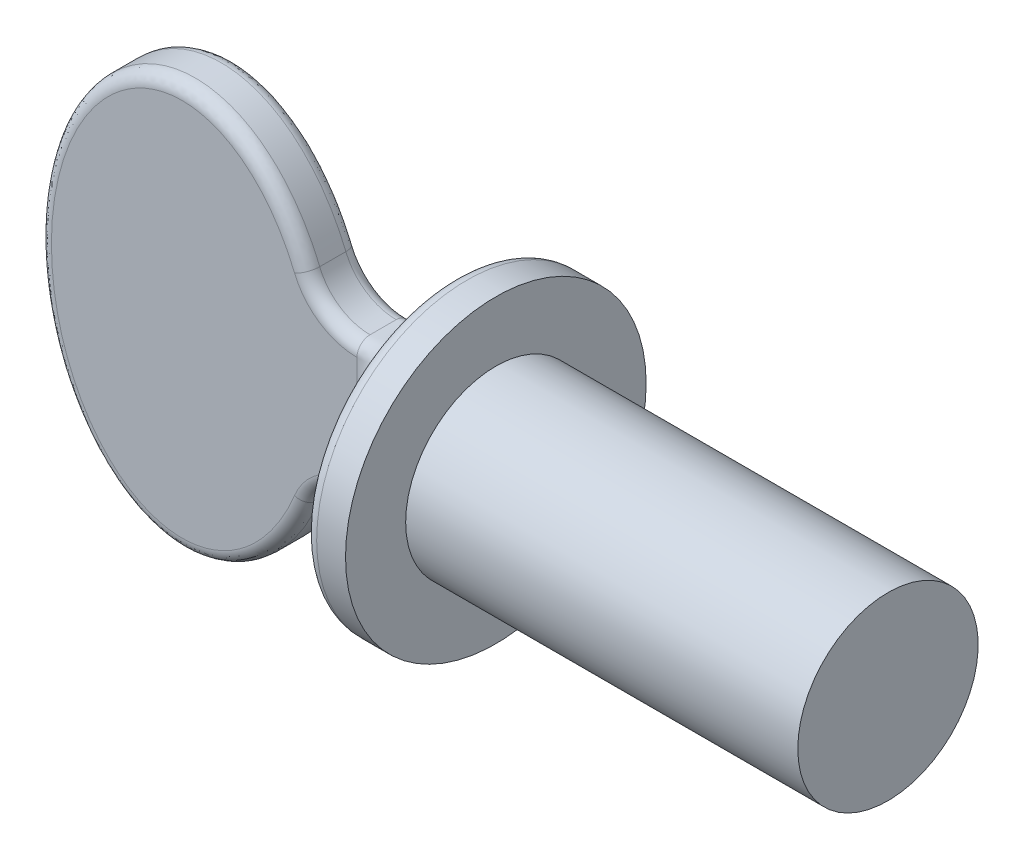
SolidWorks part; units mm, degrees
ref_plane "Front Plane" through (0, 0, 0) normal (0, 0, 1) x (1, 0, 0)
ref_plane "Top Plane" through (0, 0, 0) normal (0, 1, 0) x (1, 0, 0)
ref_plane "Right Plane" through (0, 0, 0) normal (1, 0, 0) x (0, 0, -1)
sketch "layout" plane through (0, 0, 0) normal (0, 0, 1) x (1, 0, 0)
  line L0 (0, 0) -> (13.208, 0) construction
  line L1 (5.588, 2.921) -> (5.588, -2.921)
  line L2 (3.3976, 1.3123) -> (4.8921, 1.3123) construction
  line L3 (5.588, 2.921) -> (4.7897, 2.921)
  line L4 (4.7897, 2.921) -> (4.7897, 3.2655) construction
  line L5 (4.2865, 1.706) -> (4.2865, 0)
  line L6 (4.2865, 1.706) -> (3.3355, 0.7551) construction
  line L7 (13.208, 1.7526) -> (13.208, 0)
  line L8 (3.3976, 1.3123) -> (3.3976, -1.3123)
  line L9 (13.208, 1.7526) -> (5.588, 1.7526)
  arc A0 (3.3976, 1.3123) -> (2.4197, 1.9685) centre (3.3976, 2.3692) cw
  arc A1 (4.7897, 2.921) -> (4.2865, 1.706) centre (3.0715, 2.921) cw
  arc A2 (3.3976, -1.3123) -> (2.4197, -1.9685) centre (3.3976, -2.3692) ccw
  ellipse E0 centre (0, 0) end of major axis (0, 3.937) minor radius 2.794 (2.4197, 1.9685) -> (2.4197, -1.9685) ccw
sketch "Sketch3" plane through (0, 0, 0) normal (0, 0, 1) x (1, 0, 0)
  line L0 (3.3976, 1.3123) -> (3.3976, -1.3123) construction
  line L1 (3.3976, 1.3123) -> (3.3976, -1.3123)
  arc A0 (3.3976, -1.3123) -> (2.4197, -1.9685) centre (3.3976, -2.3692) ccw construction
  arc A1 (2.4197, 1.9685) -> (3.3976, 1.3123) centre (3.3976, 2.3692) ccw construction
  arc A2 (3.3976, -1.3123) -> (2.4197, -1.9685) centre (3.3976, -2.3692) ccw
  arc A3 (2.4197, 1.9685) -> (3.3976, 1.3123) centre (3.3976, 2.3692) ccw
  ellipse E0 centre (0, 0) end of major axis (0, 3.937) minor radius 2.794 (2.4197, 1.9685) -> (2.4197, -1.9685) ccw construction
  ellipse E1 centre (0, 0) end of major axis (0, 3.937) minor radius 2.794 (2.4197, 1.9685) -> (2.4197, -1.9685) ccw
extrude "Extrude1" add sketch "Sketch3" along normal mid plane 1.016
fillet "Fillet1" radius 0.254 6 edges at (2.8088, 1.4916, -0.508) (2.8088, -1.4916, -0.508) (2.8088, 1.4916, 0.508) (2.8088, -1.4916, 0.508) (-2.794, 0, -0.508) (-2.794, 0, 0.508)
sketch "Sketch4" plane through (0, 0, 0) normal (0, 0, 1) x (1, 0, 0)
  line L1 (13.208, 1.7526) -> (5.588, 1.7526) construction
  line L2 (5.588, 2.921) -> (5.588, -2.921) construction
  line L3 (5.588, 2.921) -> (4.7897, 2.921) construction
  line L4 (4.2865, 1.706) -> (4.2865, 0) construction
  line L5 (13.208, 1.7526) -> (13.208, 0) construction
  line L6 (13.208, 1.7526) -> (5.588, 1.7526)
  line L7 (5.588, 2.921) -> (5.588, 1.7526)
  line L8 (5.588, 2.921) -> (4.7897, 2.921)
  line L9 (4.2865, 1.706) -> (4.2865, 0)
  line L10 (0, 0) -> (16.8942, 0) construction
  line L11 (13.208, 0) -> (4.2865, 0)
  line L12 (13.208, 1.7526) -> (13.208, 0)
  arc A0 (4.2865, 1.706) -> (4.7897, 2.921) centre (3.0715, 2.921) ccw construction
  arc A1 (4.2865, 1.706) -> (4.7897, 2.921) centre (3.0715, 2.921) ccw
revolve "Revolve1" add sketch "Sketch4" angle 360 about L10
loft "Loft1" add
fillet "Fillet2" radius 0.254 1 edges at (4.7897, 0, 2.921)
sketch "Sketch5" plane through (0, 0, 0) normal (0, 1, 0) x (1, 0, 0)
  line L0 (12.6625, 2.2981) -> (13.208, 2.2981)
  line L1 (13.208, 2.2981) -> (13.208, 1.7526)
  line L2 (13.208, 1.7526) -> (12.9352, 1.2802)
  line L3 (12.9352, 1.2802) -> (12.6625, 1.7526)
  line L4 (13.208, -1.7526) -> (13.208, 1.7526) construction
  line L5 (12.6625, 1.7526) -> (12.6625, 2.2981)
  line L6 (13.208, 1.7526) -> (5.588, 1.7526) construction
  line L7 (-3.6147, 0) -> (14.1406, 0) construction
revolve "Cut-Revolve10" [suppressed] cut sketch "Sketch5" angle 360 about L7
pattern_linear "LPattern10" [suppressed] count 9 along (1, 0, 0)
equation "\"D4@layout\" = \"Head Height@layout\" / 3 * 2"
equation "\"D5@layout\" = \"Head Width@layout\" / 3"
equation "\"D6@layout\" = \"Head Width@layout\" / 2"
equation "\"D7@layout\" = \"D5@layout\" * 1.3"
equation "\"D8@layout\" = \"D4@layout\"  / 7"
equation "\"D1@Fillet1\" = \"Head Thickness@Extrude1\" / 4"
equation "\"D1@Fillet2\" = \"D1@Fillet1\""
equation "\"D1@Sketch5\" = ( \"Base Screw Dia@layout\"- \"Minor Dia@Cosmetic Thread1\" )  / 2"
equation "\"D1@LPattern10\" = int((\"Length@layout\")/\"Advance@LPattern10\")"
